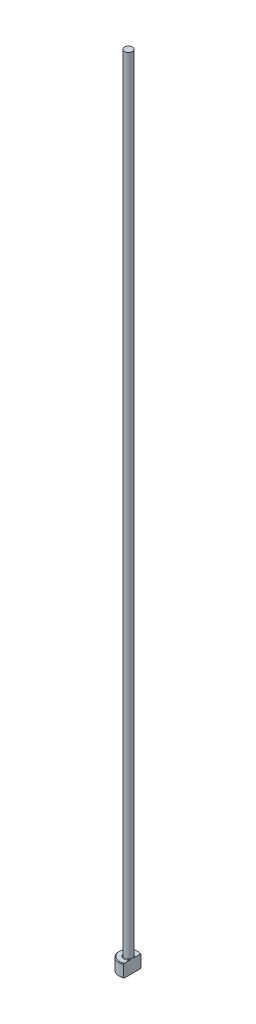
SolidWorks part; units mm, degrees
ref_plane "Front Plane" through (0, 0, 0) normal (0, 0, 1) x (1, 0, 0)
ref_plane "Top Plane" through (0, 0, 0) normal (0, 1, 0) x (1, 0, 0)
ref_plane "Right Plane" through (0, 0, 0) normal (1, 0, 0) x (0, 0, -1)
sketch "Sketch1" plane through (0, 0, 0) normal (0, 0, 1) x (1, 0, 0)
  line L0 (0, 259.9588) -> (0, -15.1925) construction
  line L1 (0, 0) -> (-3, 0)
  line L2 (-3, 0) -> (-3, 4)
  line L3 (-3, 4) -> (-1.25, 4)
  line L4 (-1.25, 4) -> (-1.25, 250)
  line L5 (-1.25, 250) -> (0, 250)
  line L6 (0, 250) -> (0, 0)
  dimension "L" = 250
  dimension "H" = 6
  dimension "T" = 4
  dimension "D" = 2.5
revolve "Revolve1" add sketch "Sketch1" angle 360 about L0
chamfer "Chamfer1" distance 0.2 angle 45 2 edges at (0, 4, 3) (0, 0, 3)
fillet "Fillet1" radius 0.2 1 edges at (0, 4, 1.25)
sketch "Sketch2" plane through (0, 0, 0) normal (0, 1, 0) x (1, 0, 0)
  line L0 (1.25, -2.7272) -> (1.25, 2.7272)
  circle A0 centre (0, 0) radius 3 construction
  arc A1 (1.25, -2.7272) -> (1.25, 2.7272) centre (0, 0) ccw
  circle A2 centre (0, 0) radius 1.25 construction
extrude "KEYED HEAD" cut sketch "Sketch2" along normal through all
